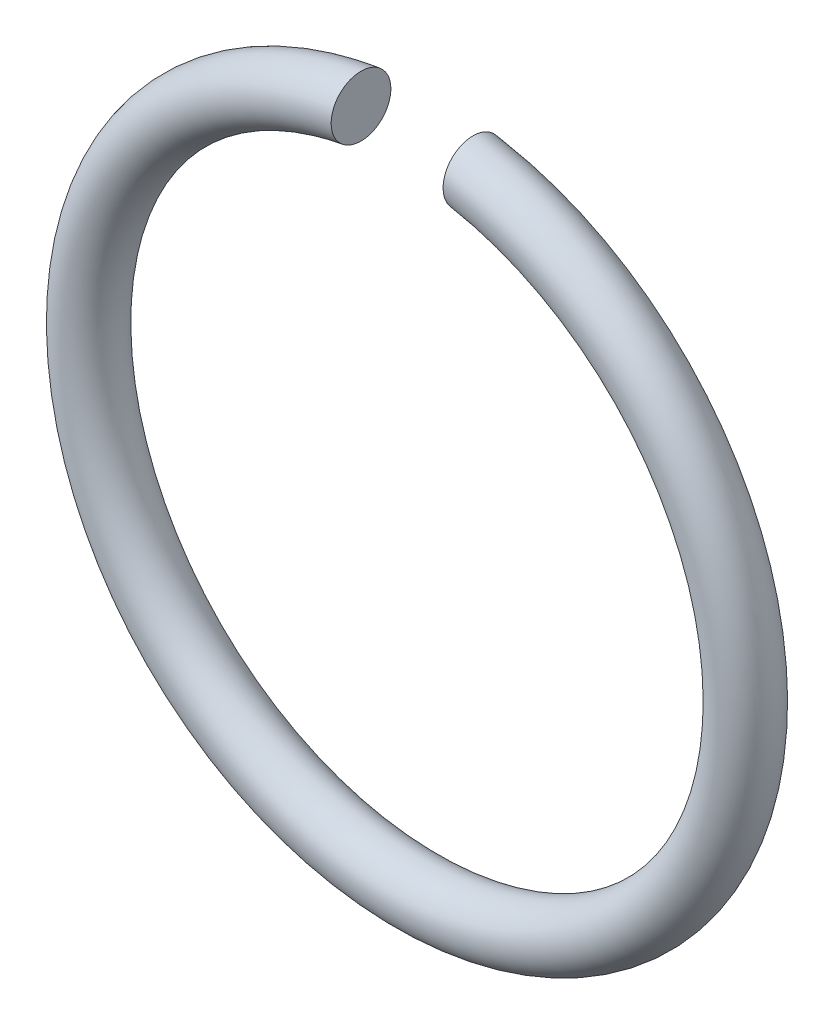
SolidWorks part; units mm, degrees
ref_plane "Front" through (0, 0, 0) normal (0, 0, 1) x (1, 0, 0)
ref_plane "Top" through (0, 0, 0) normal (0, 1, 0) x (1, 0, 0)
ref_plane "Right" through (0, 0, 0) normal (1, 0, 0) x (0, 0, -1)
sketch "Sketch1" plane through (0, 0, 0) normal (0, 0, 1) x (1, 0, 0)
  circle A1 centre (0, 0) radius 8.8
  dimension "D1" = 17.6
sketch "Sketch2" plane through (0, 0, 0) normal (0, 1, 0) x (1, 0, 0)
  circle A0 centre (8.8, 0) radius 0.8
  dimension "d1" = 1.6
sweep "Base-Sweep" add profiles "Sketch2" path "Sketch1"
sketch "Sketch3" plane through (0, 0, 0) normal (0, 0, 1) x (1, 0, 0)
  line L1 (-1.5, 0) -> (1.5, 0)
  line L2 (-1.5, 0) -> (-1.5, 9.6)
  line L3 (-1.5, 9.6) -> (1.5, 9.6)
  line L4 (1.5, 0) -> (1.5, 9.6)
  dimension "B" = 3
  dimension "B/2" = 1.5
  dimension "D3" = 9.6
extrude "Cut-Extrude1" cut sketch "Sketch3" against normal through all and the other way through all
equation "\"B/2@Sketch3\" = \"B@Sketch3\" / 2"
